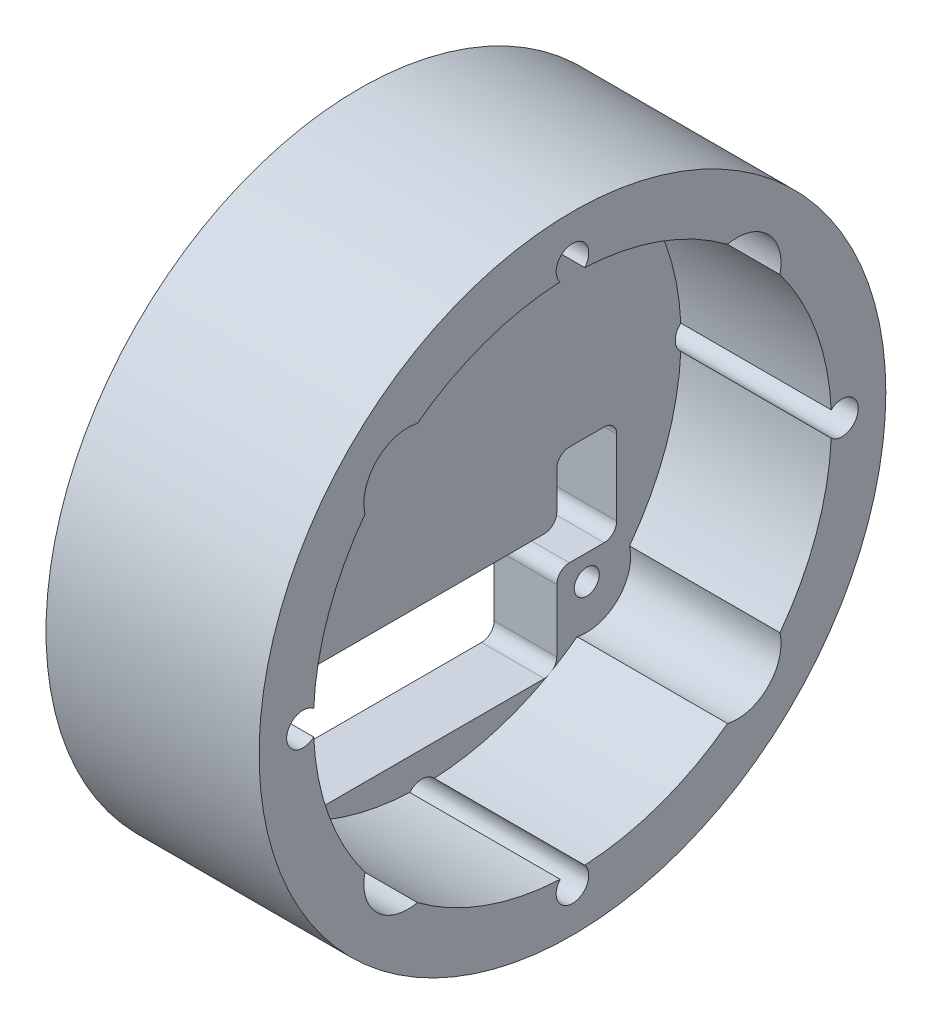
SolidWorks part; units mm, degrees
ref_plane "Front Plane" through (0, 0, 0) normal (0, 0, 1) x (1, 0, 0)
ref_plane "Top Plane" through (0, 0, 0) normal (0, 1, 0) x (1, 0, 0)
ref_plane "Right Plane" through (0, 0, 0) normal (1, 0, 0) x (0, 0, -1)
sketch "Sketch1" plane through (0, 0, 0) normal (1, 0, 0) x (0, 0, -1)
  circle A0 centre (0, 0) radius 25
  dimension "D1" = 50
extrude "Boss-Extrude1" add sketch "Sketch1" along normal blind 5
sketch "Sketch3" plane through (0, 0, 0) normal (-1, 0, 0) x (0, 0, 1)
  circle A0 centre (-13.14, 13.14) radius 1
  circle A1 centre (13.14, 13.14) radius 1
  circle A2 centre (13.14, -13.14) radius 1
  circle A3 centre (-13.14, -13.14) radius 1
  point P12 (0, 0)
  dimension "D1" = 2
  dimension "D2" = 13.14
  dimension "D3" = 13.14
  dimension "D4" = 4
extrude "Cut-Extrude2" cut sketch "Sketch3" against normal through all
sketch "Sketch4" plane through (5, 0, 0) normal (1, 0, 0) x (0, 0, -1)
  circle A0 centre (0, 0) radius 25
  circle A1 centre (0, 0) radius 20.6667
  dimension "D1" = 50
  dimension "D2" = 41.3333
extrude "Boss-Extrude2" add sketch "Sketch4" along normal blind 12
sketch "Sketch2" plane through (5, 0, 0) normal (1, 0, 0) x (0, 0, -1)
  line L0 (0, 21.5) -> (0, 25) construction
  circle A1 centre (0, 21.5) radius 1.3
  circle A3 centre (0, 0) radius 25 construction
  circle A8 centre (21.5, 0) radius 1.3
  circle A9 centre (0, -21.5) radius 1.3
  circle A10 centre (-21.5, 0) radius 1.3
  point P16 (0, 0)
  dimension "D2" = 2.6
  dimension "D1" = 21.5
  dimension "D3" = 4
extrude "Cut-Extrude1" cut sketch "Sketch2" against normal through all both and the other way through all
sketch "Sketch5" plane through (5, 0, 0) normal (1, 0, 0) x (0, 0, -1)
  line L0 (-13.14, -13.14) -> (13.14, -13.14) construction
  line L1 (9.75, -8.14) -> (-9.75, -8.14)
  line L2 (10.75, -12.14) -> (10.75, -17.14)
  line L3 (9.75, -18.14) -> (-9.75, -18.14)
  line L4 (-10.75, -9.14) -> (-10.75, -17.14)
  line L5 (10.75, -8.14) -> (-10.75, -18.14) construction
  line L6 (10.75, -18.14) -> (-10.75, -8.14) construction
  line L8 (14.53, -3.14) -> (11.75, -3.14)
  line L9 (15.53, -4.14) -> (15.53, -10.14)
  line L10 (14.53, -11.14) -> (11.75, -11.14)
  line L11 (10.75, -4.14) -> (10.75, -7.14)
  line L12 (15.53, -3.14) -> (10.75, -11.14) construction
  line L13 (15.53, -11.14) -> (10.75, -3.14) construction
  arc A0 (11.75, -11.14) -> (10.75, -12.14) centre (11.75, -12.14) ccw
  arc A1 (-10.75, -9.14) -> (-9.75, -8.14) centre (-9.75, -9.14) cw
  arc A2 (-9.75, -18.14) -> (-10.75, -17.14) centre (-9.75, -17.14) cw
  arc A3 (10.75, -17.14) -> (9.75, -18.14) centre (9.75, -17.14) cw
  arc A4 (15.53, -10.14) -> (14.53, -11.14) centre (14.53, -10.14) cw
  arc A5 (10.75, -4.14) -> (11.75, -3.14) centre (11.75, -4.14) cw
  arc A6 (15.53, -4.14) -> (14.53, -3.14) centre (14.53, -4.14) ccw
  arc A7 (9.75, -8.14) -> (10.75, -7.14) centre (9.75, -7.14) ccw
  point P0 (0, -13.14)
  point P5 (13.14, -7.14)
  dimension "D5" = 1
  dimension "D6" = 1
  dimension "D1" = 10
  dimension "D2" = 21.5
  dimension "D3" = 8
  dimension "D4" = 2
extrude "Cut-Extrude3" cut sketch "Sketch5" against normal through all
sketch "Sketch7" plane through (5, 0, 0) normal (1, 0, 0) x (0, 0, -1)
  line L0 (-13.14, 13.14) -> (13.14, -13.14) construction
  line L1 (-10.6651, 15.6149) -> (0, 4.9497)
  line L2 (-15.6149, 10.6651) -> (-4.9497, 0)
  line L3 (13.14, 13.14) -> (-13.14, -13.14) construction
  line L4 (15.6149, 10.6651) -> (4.9497, 0)
  line L5 (10.6651, 15.6149) -> (0, 4.9497)
  line L6 (0, -4.9497) -> (10.6651, -15.6149)
  line L7 (0, -4.9497) -> (-10.6651, -15.6149)
  line L8 (4.9497, 0) -> (15.6149, -10.6651)
  line L9 (-4.9497, 0) -> (-15.6149, -10.6651)
  arc A0 (-10.6651, 15.6149) -> (-15.6149, 10.6651) centre (-13.14, 13.14) ccw
  arc A1 (10.6651, -15.6149) -> (15.6149, -10.6651) centre (13.14, -13.14) ccw
  arc A2 (15.6149, 10.6651) -> (10.6651, 15.6149) centre (13.14, 13.14) ccw
  arc A3 (-15.6149, -10.6651) -> (-10.6651, -15.6149) centre (-13.14, -13.14) ccw
  point P2 (0, 0)
  point P11 (0, 0)
extrude "Cut-Extrude5" cut sketch "Sketch7" along normal through all
